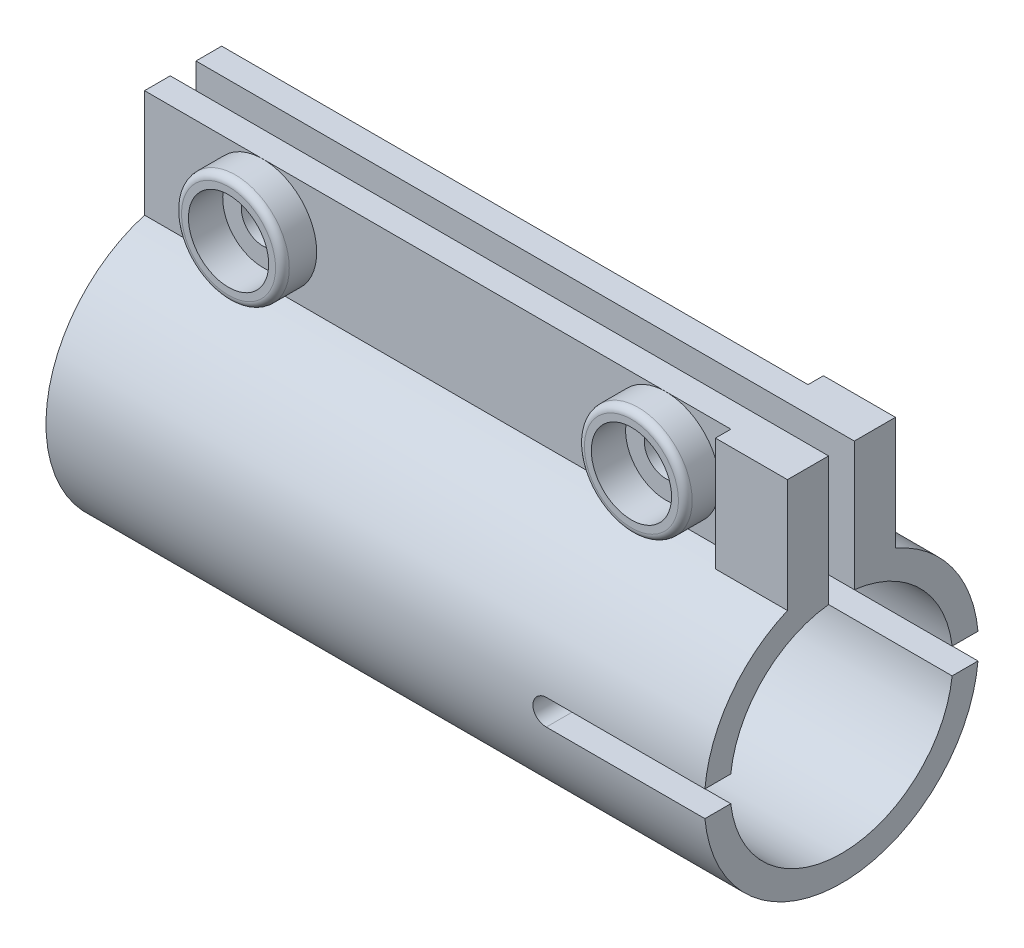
SolidWorks part; units mm, degrees
ref_plane "Front" through (0, 0, 0) normal (0, 0, 1) x (1, 0, 0)
ref_plane "Top" through (0, 0, 0) normal (0, 1, 0) x (1, 0, 0)
ref_plane "Right" through (0, 0, 0) normal (1, 0, 0) x (0, 0, -1)
sketch "Sketch1" plane through (0, 0, 0) normal (1, 0, 0) x (0, 0, -1)
  circle A0 centre (0, 0) radius 8.255
  dimension "D1" = 16.51
extrude "Base-Extrude" add sketch "Sketch1" against normal blind 48.768
shell "Shell1" thickness 1.905
sketch "Sketch2" plane through (0, 0, 0) normal (0, 0, 1) x (1, 0, 0)
  line L0 (0, 0.9525) -> (-11.7475, 0.9525)
  line L1 (0, 0.9525) -> (0, -0.9525)
  line L2 (-11.7475, -0.9525) -> (0, -0.9525)
  line L6 (0, 10.16) -> (0, -10.16) construction
  arc A0 (-11.7475, 0.9525) -> (-11.7475, -0.9525) centre (-11.7475, 0) ccw
  dimension "D1" = 1.905
  dimension "D2" = 12.7
extrude "Cut-Extrude1" cut sketch "Sketch2" against normal through all and the other way through all
sketch "Sketch3" plane through (0, 0, 0) normal (1, 0, 0) x (0, 0, -1)
  line L0 (0.9525, 0) -> (-0.9525, 0)
  line L1 (0.9525, 0) -> (0.9525, 10.16)
  line L2 (-0.9525, 10.16) -> (0.9525, 10.16)
  line L3 (-0.9525, 10.16) -> (-0.9525, 0)
  arc A0 (10.1153, 0.9525) -> (-10.1153, 0.9525) centre (0, 0) ccw construction
  dimension "D1" = 1.905
extrude "Cut-Extrude2" cut sketch "Sketch3" against normal through all
sketch "Sketch4" plane through (0, 0, 0) normal (1, 0, 0) x (0, 0, -1)
  line L0 (-0.9525, 8.1999) -> (-2.8575, 8.1999)
  line L1 (-0.9525, 8.1999) -> (-0.9525, 17.7353)
  line L2 (-2.8575, 17.7353) -> (-0.9525, 17.7353)
  line L3 (-2.8575, 17.7353) -> (-2.8575, 8.1999)
  line L4 (0.9525, 8.1999) -> (2.8575, 8.1999)
  line L5 (0.9525, 8.1999) -> (0.9525, 17.7353)
  line L6 (2.8575, 17.7353) -> (0.9525, 17.7353)
  line L7 (2.8575, 17.7353) -> (2.8575, 8.1999)
  dimension "D1" = 1.905
  dimension "D2" = 7.62
extrude "Boss-Extrude2" add sketch "Sketch4" against normal through all
sketch "Sketch6" plane through (0, 0, 0) normal (1, 0, 0) x (0, 0, -1)
  line L0 (-2.8575, 17.7353) -> (-4.0005, 17.7353)
  line L1 (-2.8575, 17.7353) -> (-2.8575, 9.3393)
  line L2 (-4.0005, 9.3393) -> (-2.8575, 9.3393)
  line L3 (-4.0005, 9.3393) -> (-4.0005, 17.7353)
  line L4 (2.8575, 17.7353) -> (4.0005, 17.7353)
  line L5 (2.8575, 17.7353) -> (2.8575, 9.3393)
  line L6 (4.0005, 9.3393) -> (2.8575, 9.3393)
  line L7 (4.0005, 9.3393) -> (4.0005, 17.7353)
  arc A0 (-2.8575, 9.7499) -> (-10.1153, 0.9525) centre (0, 0) ccw construction
  arc A1 (10.1153, 0.9525) -> (2.8575, 9.7499) centre (0, 0) ccw construction
  dimension "D1" = 1.143
extrude "Boss-Extrude4" add sketch "Sketch6" against normal blind 5.334
sketch "Sketch7" plane through (0, 0, 2.8575) normal (0, 0, 1) x (1, 0, 0)
  line L0 (-48.768, 17.7353) -> (-48.768, 9.7499) construction
  circle A2 centre (-10.16, 13.7414) radius 1.5875
  circle A3 centre (-40.005, 13.7414) radius 1.5875
  dimension "D2" = 29.845
  dimension "D3" = 3.175
  dimension "D4" = 13.7414
  dimension "D1" = 8.763
extrude "Cut-Extrude3" cut sketch "Sketch7" against normal up to next
sketch "Sketch8" plane through (0, 0, -2.8575) normal (0, 0, -1) x (-1, 0, 0)
  line L0 (48.768, 0) -> (0, 0) construction
  line L1 (0, 9.3393) -> (0, 0.9525) construction
  circle A2 centre (40.005, 13.7414) radius 1.5875
  circle A3 centre (10.16, 13.7414) radius 1.5875
  dimension "D1" = 13.7414
  dimension "D2" = 29.845
  dimension "D3" = 3.175
  dimension "D4" = 10.16
extrude "Cut-Extrude4" cut sketch "Sketch8" against normal up to next
sketch "Sketch9" plane through (0, 0, 2.8575) normal (0, 0, 1) x (1, 0, 0)
  line L0 (-48.768, 9.7499) -> (-5.334, 9.7499) construction
  circle A0 centre (-40.005, 13.7414) radius 3.9915
  circle A1 centre (-10.16, 13.7414) radius 3.9915
  circle A2 centre (-40.005, 13.7414) radius 2.9718
  circle A3 centre (-10.16, 13.7414) radius 2.9718
  dimension "D1" = 7.983
  dimension "D2" = 5.9436
extrude "Boss-Extrude5" add sketch "Sketch9" along normal blind 2.54
fillet "Fillet1" radius 0.508 2 edges at (-36.0135, 13.7414, 5.3975) (-6.1685, 13.7414, 5.3975)
